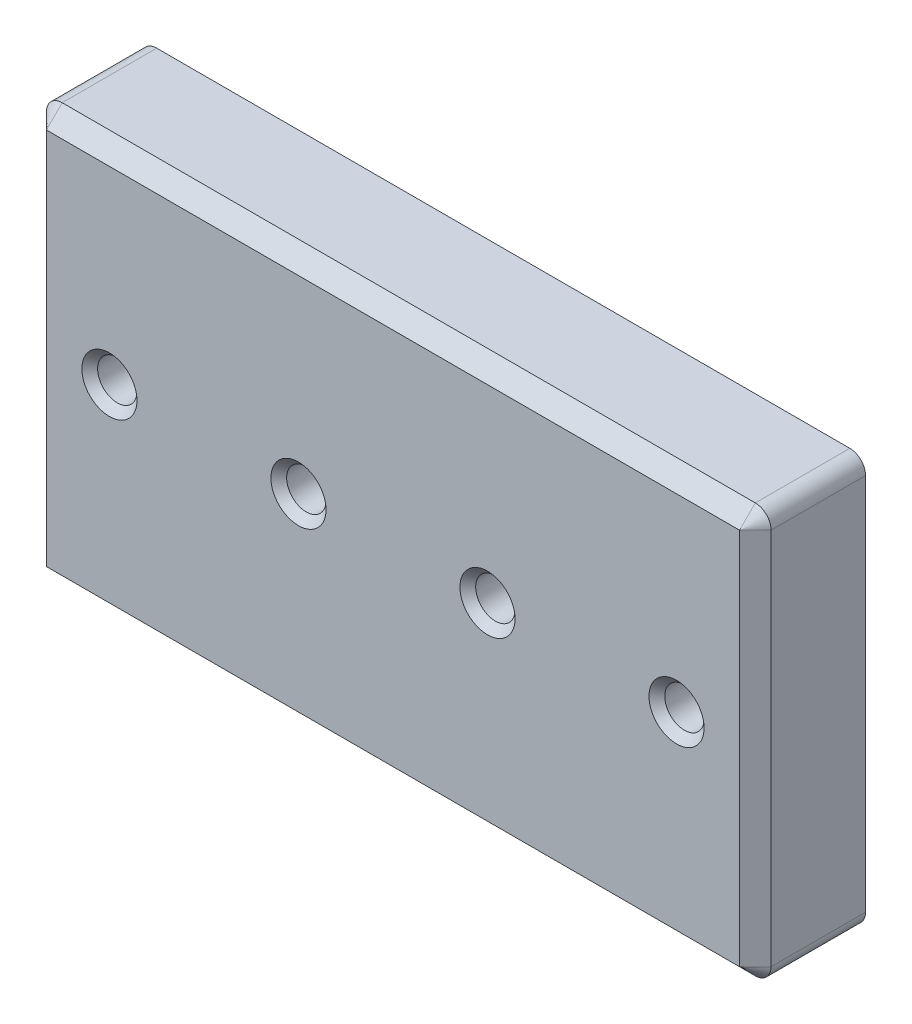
SolidWorks part; units mm, degrees
ref_plane "Front Plane" through (0, 0, 0) normal (0, 0, 1) x (1, 0, 0)
ref_plane "Top Plane" through (0, 0, 0) normal (0, 1, 0) x (1, 0, 0)
ref_plane "Right Plane" through (0, 0, 0) normal (1, 0, 0) x (0, 0, -1)
sketch "Sketch1" plane through (0, 0, 0) normal (0, 0, 1) x (1, 0, 0)
  line L0 (-18, 0) -> (18, 0) construction
  line L1 (23, -13) -> (-23, -13)
  line L2 (23, -13) -> (23, 13)
  line L3 (23, 13) -> (-23, 13)
  line L4 (-23, -13) -> (-23, 13)
  line L5 (23, -13) -> (-23, 13) construction
  line L6 (23, 13) -> (-23, -13) construction
  circle A0 centre (-18, 0) radius 1.25
  circle A1 centre (-18, 0) radius 5 construction
  circle A2 centre (18, 0) radius 1.25
  circle A3 centre (6, 0) radius 1.25
  circle A4 centre (-6, 0) radius 1.25
  point P0 (0, 0)
extrude "Boss-Extrude1" add sketch "Sketch1" along normal blind 7
chamfer "Chamfer1" distance 0.5 angle 45 4 edges at (19.25, 0, 7) (7.25, 0, 7) (-4.75, 0, 7) (-16.75, 0, 7)
fillet "Fillet1" radius 1 4 edges at (-23, 13, 3.5) (23, 13, 3.5) (23, -13, 3.5) (-23, -13, 3.5)
chamfer "Chamfer2" distance 1 angle 45 8 edges at (0, -13, 7) (22.7071, -12.7071, 7) (-22.7071, -12.7071, 7) (23, 0, 7) (-23, 0, 7) (22.7071, 12.7071, 7) (-22.7071, 12.7071, 7) (0, 13, 7)
equation "\"D4@Sketch1\"=\"D1@Sketch1\"/3"
equation "\"D5@Sketch1\"=\"D4@Sketch1\""
